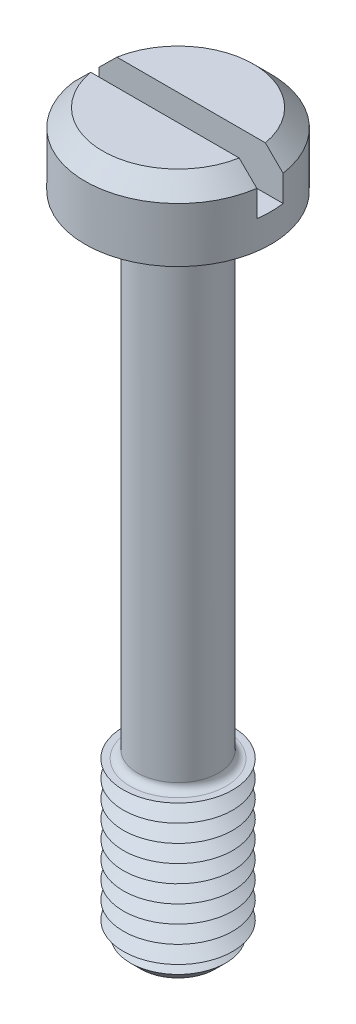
SolidWorks part; units mm, degrees
ref_plane "Front Plane" through (0, 0, 0) normal (0, 0, 1) x (1, 0, 0)
ref_plane "Top Plane" through (0, 0, 0) normal (0, 1, 0) x (1, 0, 0)
ref_plane "Right Plane" through (0, 0, 0) normal (1, 0, 0) x (0, 0, -1)
sketch "Sketch1" plane through (0, 0, 0) normal (0, 1, 0) x (1, 0, 0)
  circle A0 centre (0, 0) radius 4.25
  dimension "D1" = 8.5
extrude "Boss-Extrude1" add sketch "Sketch1" along normal blind 3.3
sketch "Sketch2" plane through (0, 0, 0) normal (0, -1, 0) x (1, 0, 0)
  circle A0 centre (0, 0) radius 1.85
  dimension "D1" = 3.7
extrude "Boss-Extrude2" add sketch "Sketch2" along normal blind 30
sketch "Sketch3" plane through (0, -30, 0) normal (0, -1, 0) x (1, 0, 0)
  circle A0 centre (0, 0) radius 2.5
  dimension "D1" = 5
extrude "Boss-Extrude3" add sketch "Sketch3" against normal blind 7.5
chamfer "Chamfer1" distance 0.8 angle 45 1 edges at (0, -30, -2.5)
sketch "Sketch4" plane through (0, 0, 0) normal (1, 0, 0) x (0, 0, -1)
  line L0 (0, -6.5871) -> (0, -12.0372) construction
sketch "Sketch5" plane through (0, 0, 0) normal (1, 0, 0) x (0, 0, -1)
  line L0 (-2.5, -22.5) -> (-1.8072, -22.9)
  line L1 (-1.8072, -22.9) -> (-2.5, -23.3)
  line L2 (-2.5, -22.5) -> (-2.5, -29.2) construction
  line L3 (-2.5, -23.3) -> (-2.5, -22.5)
  dimension "D1" = 0.8
revolve "Cut-Revolve1" cut sketch "Sketch5" angle 360 about L0
pattern_linear "LPattern1" count 9 spacing 0.8 along (0, -1, 0) of "Cut-Revolve1"
fillet "Fillet1" radius 0.35 2 edges at (0, -22.5, -1.85) (0, 0, -1.85)
chamfer "Chamfer2" distance 0.8 angle 45 1 edges at (0, 3.3, 4.25)
sketch "Sketch6" plane through (0, 3.3, 0) normal (0, 1, 0) x (1, 0, 0)
  line L1 (4.25, -0.6) -> (-4.25, -0.6)
  line L2 (4.25, -0.6) -> (4.25, 0.6)
  line L3 (4.25, 0.6) -> (-4.25, 0.6)
  line L4 (-4.25, -0.6) -> (-4.25, 0.6)
  line L5 (4.25, -0.6) -> (-4.25, 0.6) construction
  line L6 (4.25, 0.6) -> (-4.25, -0.6) construction
  circle A0 centre (0, 0) radius 4.25 construction
  point P0 (0, 0)
  dimension "D1" = 1.2
extrude "Cut-Extrude1" cut sketch "Sketch6" against normal blind 2
